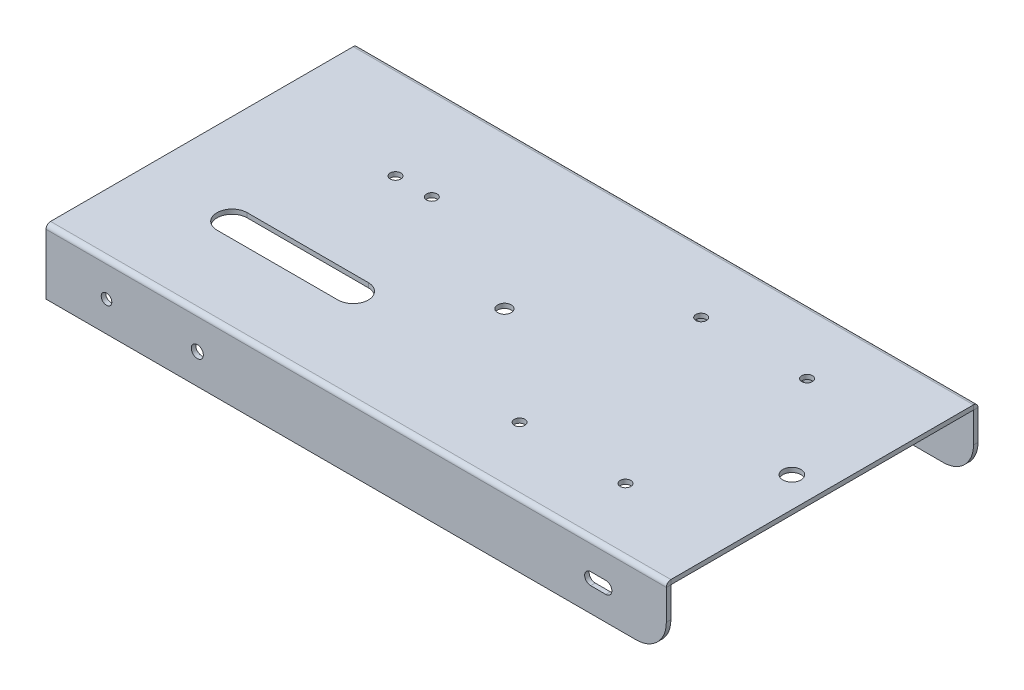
SolidWorks part; units mm, degrees
ref_plane "Front Plane" through (0, 0, 0) normal (0, 0, 1) x (1, 0, 0)
ref_plane "Top Plane" through (0, 0, 0) normal (0, 1, 0) x (1, 0, 0)
ref_plane "Right Plane" through (0, 0, 0) normal (1, 0, 0) x (0, 0, -1)
sketch "Sketch1" plane through (0, 0, 0) normal (0, 1, 0) x (1, 0, 0)
  line L0 (0, 0) -> (205, 0) construction
  line L1 (0, -70) -> (0, 70)
  line L2 (0, 70) -> (195, 70)
  line L3 (205, 60) -> (205, -60)
  line L4 (180, 60) -> (185, 60) construction
  line L5 (180, 62) -> (185, 62)
  line L6 (185, 58) -> (180, 58)
  line L7 (100, 60) -> (50, 60) construction
  line L8 (50, 60) -> (20, 60) construction
  line L9 (100, 60) -> (180, 60) construction
  line L10 (170, 30) -> (135, 30) construction
  line L11 (170, -30) -> (135, -30) construction
  line L12 (180, -60) -> (50, -60) construction
  line L13 (50, -60) -> (20, -60) construction
  line L14 (100, 0) -> (100, 60) construction
  line L15 (0, -70) -> (195, -70)
  line L16 (185, 60) -> (195, 60) construction
  line L17 (180, -60) -> (185, -60) construction
  line L18 (185, -60) -> (195, -60) construction
  line L19 (185, -58) -> (180, -58)
  line L20 (180, -62) -> (185, -62)
  line L21 (70, -20) -> (30, -20) construction
  line L22 (56, 20) -> (44, 20) construction
  line L23 (70, -15) -> (30, -15)
  line L24 (30, -25) -> (70, -25)
  arc A0 (205, 60) -> (195, 70) centre (195, 60) ccw
  arc A1 (180, 62) -> (180, 58) centre (180, 60) ccw
  arc A2 (185, 58) -> (185, 62) centre (185, 60) ccw
  circle A3 centre (100, 60) radius 1.75
  circle A4 centre (50, 60) radius 2
  circle A5 centre (20, 60) radius 1.75
  circle A6 centre (170, 30) radius 1.75
  circle A7 centre (135, 30) radius 1.75
  circle A8 centre (135, -30) radius 1.75
  circle A9 centre (170, -30) radius 1.75
  circle A10 centre (20, -60) radius 1.75
  circle A11 centre (50, -60) radius 2
  arc A12 (180, -58) -> (180, -62) centre (180, -60) ccw
  arc A13 (205, -60) -> (195, -70) centre (195, -60) cw
  arc A14 (185, -62) -> (185, -58) centre (185, -60) ccw
  arc A15 (30, -15) -> (30, -25) centre (30, -20) ccw
  circle A16 centre (195, 0) radius 3
  circle A17 centre (100, 0) radius 2.25
  arc A18 (70, -25) -> (70, -15) centre (70, -20) ccw
  circle A19 centre (44, 20) radius 1.75
  circle A20 centre (56, 20) radius 1.75
  dimension "D1" = 10
  dimension "D7" = 3.5
  dimension "D8" = 4
  dimension "D9" = 3.5
  dimension "D10" = 20
  dimension "D12" = 50
  dimension "D13" = 3.5
  dimension "D14" = 3.5
  dimension "D16" = 35
  dimension "D17" = 35
  dimension "D18" = 4.5
  dimension "D19" = 6
  dimension "D20" = 10
  dimension "D24" = 5
  dimension "D25" = 3.5
  dimension "D27" = 12
  dimension "D28" = 30
  dimension "D4" = 2
  dimension "D5" = 20
  dimension "D21" = 2
  dimension "D23" = 5
  dimension "D26" = 40
  dimension "D30" = 40
  dimension "D31" = 14
  dimension "D2" = 70
  dimension "D3" = 205
  dimension "D6" = 5
  dimension "D11" = 30
  dimension "D15" = 30
  dimension "D22" = 20
  dimension "D29" = 20
sheet metal parameters "Sheet-Metal1" thickness 1.5 parameters "D1"=1
base flange "Base-Flange1" sketch "Sketch1" thickness 1.5 reverse thickness direction yes parameters "D1"=1
sketch "Sketch3" plane through (0, 1.5, 0) normal (0, 1, 0) x (1, 0, 0)
  line L0 (0, 50) -> (205, 50)
  line L1 (0, 70) -> (0, -70) construction
  line L2 (205, -60) -> (205, 60) construction
  line L3 (0, -50) -> (205, -50)
  line L4 (195, 70) -> (0, 70) construction
  line L5 (0, -70) -> (195, -70) construction
  dimension "D1" = 20
  dimension "D2" = 20
sketched bend "Sketched Bend1" parameters "D1"=0
bend "SketchBend1" bend radius 0 bend angle 90 parameters "D5"=1
bend "SketchBend2" bend radius 0 bend angle 90 parameters "D5"=2
flat pattern "Flat-Pattern1"
sketch "Bend-Lines1" plane through (0, 0, 0) normal (0, 1, 0) x (-1, 0, 0)
bend of the flat pattern "Flatten-<SketchBend1>1"
bend of the flat pattern "Flatten-<SketchBend2>1"
